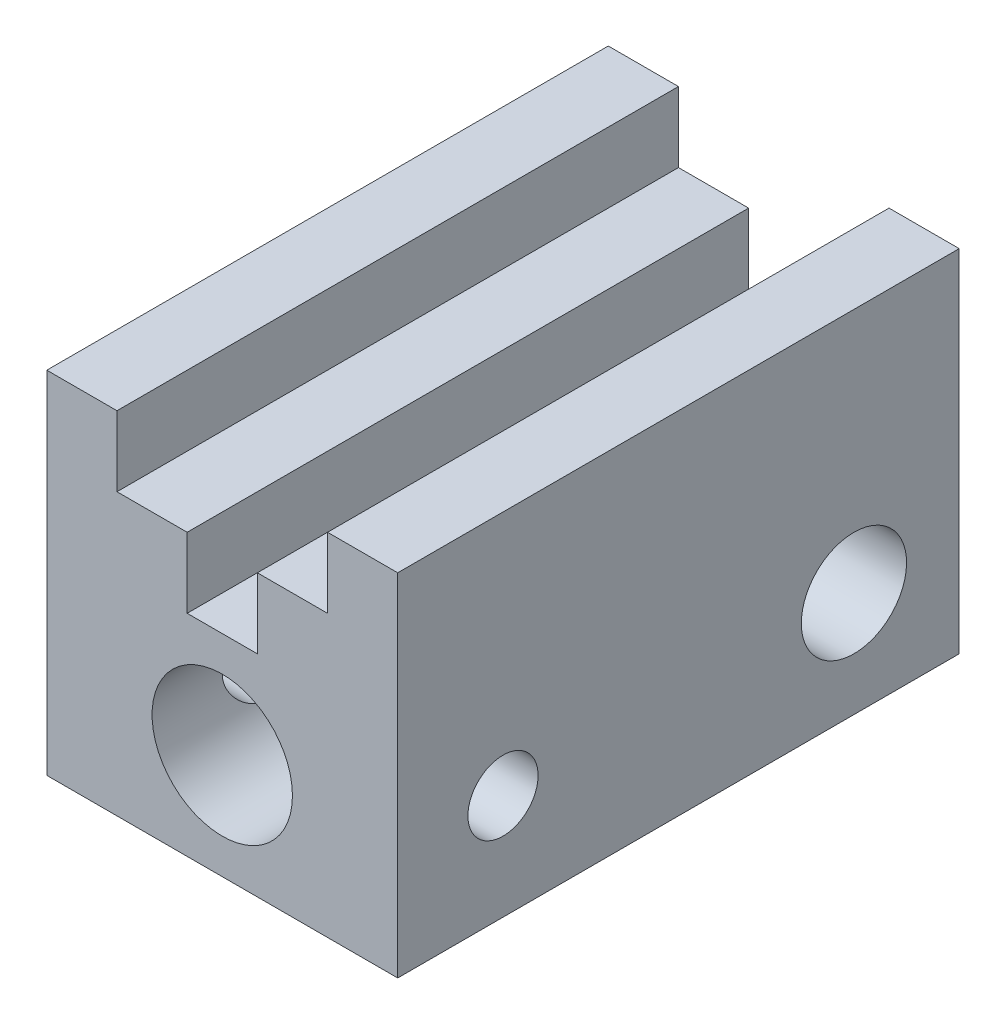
SolidWorks part; units mm, degrees
ref_plane "正面" through (0, 0, 0) normal (0, 0, 1) x (1, 0, 0)
ref_plane "平面" through (0, 0, 0) normal (0, 1, 0) x (1, 0, 0)
ref_plane "右側面" through (0, 0, 0) normal (1, 0, 0) x (0, 0, -1)
sketch "ｽｹｯﾁ1" plane through (0, 0, 0) normal (0, 0, 1) x (1, 0, 0)
  line L0 (-15, 50) -> (-15, 40)
  line L1 (-25, 50) -> (-15, 50)
  line L2 (-25, 50) -> (-25, 0)
  line L3 (-25, 0) -> (25, 0)
  line L4 (25, 50) -> (25, 0)
  line L5 (-15, 40) -> (-5, 40)
  line L6 (-5, 40) -> (-5, 30)
  line L7 (-5, 30) -> (5, 30)
  line L8 (5, 30) -> (5, 40)
  line L9 (5, 40) -> (15, 40)
  line L10 (15, 40) -> (15, 50)
  line L11 (15, 50) -> (25, 50)
  circle A0 centre (0, 15) radius 10
  dimension "D3" = 20
  dimension "D1" = 50
  dimension "D2" = 50
  dimension "D4" = 15
  dimension "D5" = 10
  dimension "D6" = 10
  dimension "D7" = 10
  dimension "D8" = 10
  dimension "D9" = 10
  dimension "D10" = 10
  dimension "D11" = 10
extrude "押し出し1" add sketch "ｽｹｯﾁ1" against normal blind 80
sketch "ｽｹｯﾁ2" plane through (25, 0, 0) normal (1, 0, 0) x (0, 0, -1)
  line L0 (80, 0) -> (0, 0) construction
  line L1 (0, 0) -> (0, 50) construction
  line L2 (80, 0) -> (80, 50) construction
  circle A0 centre (15, 15) radius 5
  circle A1 centre (65, 15) radius 7.5
  dimension "D1" = 10
  dimension "D2" = 15
  dimension "D3" = 15
  dimension "D4" = 15
  dimension "D5" = 15
  dimension "D6" = 15
extrude "ｶｯﾄ - 押し出し1" cut sketch "ｽｹｯﾁ2" against normal through all
